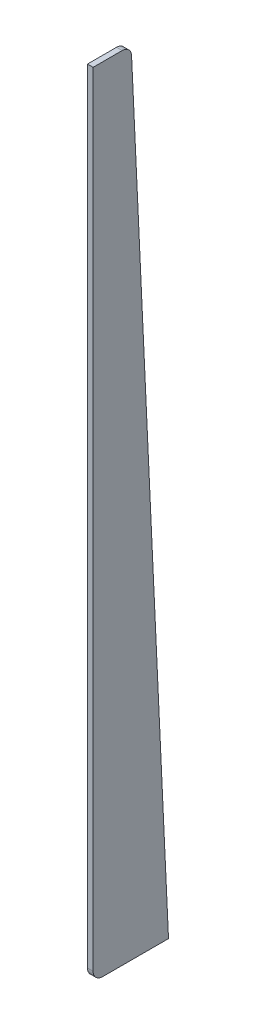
SolidWorks part; units mm, degrees
ref_plane "Plan de face" through (0, 0, 0) normal (0, 0, 1) x (1, 0, 0)
ref_plane "Plan de dessus" through (0, 0, 0) normal (0, 1, 0) x (1, 0, 0)
ref_plane "Plan de droite" through (0, 0, 0) normal (1, 0, 0) x (0, 0, -1)
sketch "Esquisse1" plane through (0, 0, 0) normal (1, 0, 0) x (0, 0, -1)
  line L0 (0, 0) -> (15.4, 0)
  line L1 (20.3944, -4.7645) -> (40, -420.5)
  line L2 (40, -420.5) -> (5, -420.5)
  line L3 (0, -415.5) -> (0, 0)
  arc A0 (5, -420.5) -> (0, -415.5) centre (5, -415.5) cw
  arc A1 (15.4, 0) -> (20.3944, -4.7645) centre (15.4, -5) cw
  dimension "D2" = 5
  dimension "D6" = 5
  dimension "D1" = 415.5
  dimension "D3" = 35
  dimension "D5" = 87.3
extrude "Extrusion1" add sketch "Esquisse1" along normal blind 3
